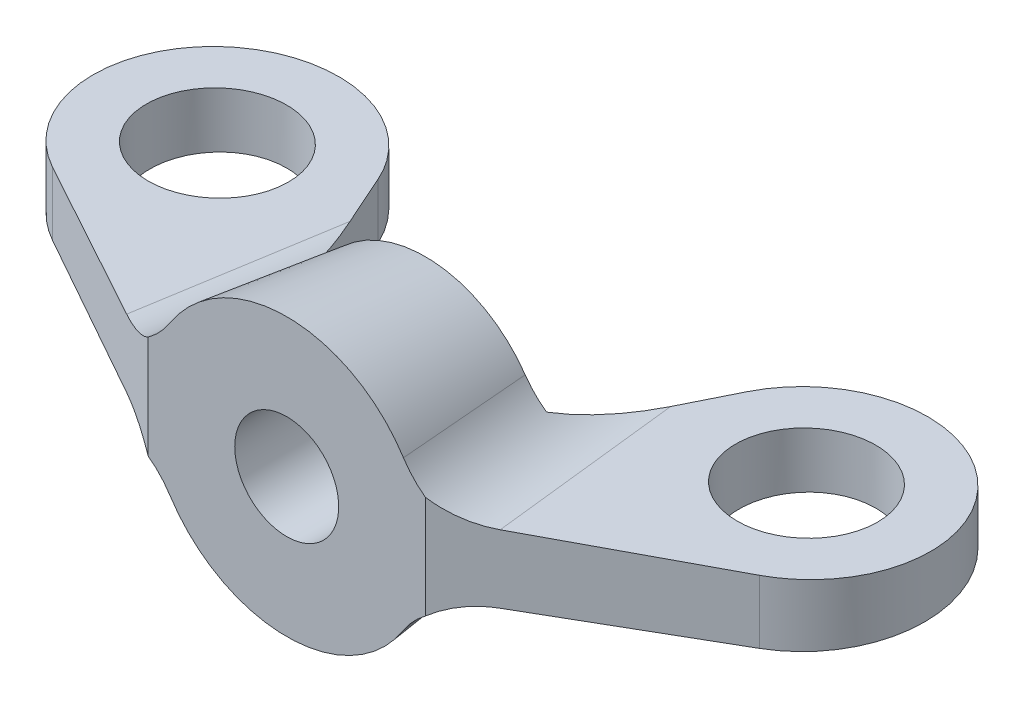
SolidWorks part; units mm, degrees
ref_plane "Front" through (0, 0, 0) normal (0, 0, 1) x (1, 0, 0)
ref_plane "Top" through (0, 0, 0) normal (0, 1, 0) x (1, 0, 0)
ref_plane "Right" through (0, 0, 0) normal (1, 0, 0) x (0, 0, -1)
other "Configuration Table"
sketch "Sketch1" plane through (0, 0, 0) normal (0, 1, 0) x (1, 0, 0)
  line L0 (0, 0) -> (-4, 0)
  line L1 (-4, 0) -> (-3.5, 4)
  line L2 (-3.5, 4) -> (0, 4)
  line L3 (0, 4) -> (0, 0)
  line L4 (0, 81.8931) -> (0, -68.5988) construction
revolve "BaseNut" add sketch "Sketch1" angle 360 about L4
ref_plane "Plane1" through (0, 0, -10) normal (0, 0, 1) x (1, 0, 0)
sketch "Sketch2" plane through (0, 0, 0) normal (0, 0, 1) x (1, 0, 0)
  line L0 (0, 0) -> (1.301, 0) construction
  line L1 (-12, -1) -> (0, -1)
  line L2 (-12, -1) -> (-12, 1)
  line L3 (-12, 1) -> (0, 1)
  line L4 (0, -1) -> (0, 1)
sketch "Sketch3" plane through (17.5788, 0, -10) normal (0, 0, 1) x (-1, 0, 0)
  line L0 (14.5626, 0) -> (37.334, 0) construction
  line L1 (17.5788, -0.75) -> (29.5788, -0.75)
  line L2 (17.5788, -0.75) -> (17.5788, 0.75)
  line L3 (17.5788, 0.75) -> (29.5788, 0.75)
  line L4 (29.5788, -0.75) -> (29.5788, 0.75)
  line L5 (29.5788, 1) -> (29.5788, -1) construction
  dimension "y" = 1.5
loft "Loft1" add profiles "Sketch3", "Sketch2"
sketch "Sketch4" plane through (0, 0, 0) normal (0, 1, 0) x (1, 0, 0)
  line L0 (-4, 0) -> (-10.1983, 3.4396)
  line L2 (-3.5, 4) -> (-5.3195, 7.961)
  line L4 (0, 12.3693) -> (0, -0.3633) construction
  line L6 (-3.5, 4) -> (0, 4)
  line L7 (0, 4) -> (0, 11)
  line L8 (-4, 0) -> (-13, 0)
  line L9 (-3.873, 0) -> (-12, 0) construction
  line L10 (0, 11) -> (-13, 11)
  line L11 (-13, 11) -> (-13, 0)
  line L12 (3.5, 4) -> (-3.3823, 4) construction
  line L13 (-3.873, 0) -> (4, 0) construction
  arc A0 (-5.3195, 7.961) -> (-10.1983, 3.4396) centre (-8.5, 6.5) ccw
extrude "Cut-Extrude1" cut sketch "Sketch4" against normal through all and the other way through all
fillet "Fillet1" radius 2.5 2 edges
mirror "Mirror1" about plane through (0, 0, 0) normal (1, 0, 0) of "Fillet1", "Cut-Extrude1", "Loft1"
sketch "Sketch5" plane through (1.6375, -0.8948, -4) normal (0, 0, -1) x (-1, 0, 0)
  circle A0 centre (1.6375, 0.8948) radius 1.5
  arc A1 (-1.2448, -1.0908) -> (4.5197, -1.0908) centre (1.6375, 0.8948) ccw construction
extrude "Hole1" cut sketch "Sketch5" against normal through all
sketch "Sketch7" plane through (0, 0, 0) normal (0, 1, 0) x (1, 0, 0)
  circle A0 centre (-8.5, 6.5) radius 2
  circle A1 centre (8.5, 6.5) radius 2
  arc A2 (-5.3195, 7.961) -> (-10.1983, 3.4396) centre (-8.5, 6.5) ccw construction
  arc A3 (10.1983, 3.4396) -> (5.3195, 7.961) centre (8.5, 6.5) ccw construction
  dimension "D1" = 4
extrude "Hole2" cut sketch "Sketch7" against normal through all and the other way through all
sketch "Sketch8" plane through (0, 0, 0) normal (0, 1, 0) x (1, 0, 0)
  line L0 (0, 7.8239) -> (0, -2.3836) construction
  line L1 (1.25, 0.125) -> (1.5, 0.125)
  line L2 (1.5, 0.125) -> (1.7165, 0)
  line L3 (1.7165, 0) -> (1.5, -0.125)
  line L4 (1.5, -0.125) -> (1.25, -0.125)
  line L5 (1.25, -0.125) -> (1.25, 0.125)
  line L7 (-1.5, 0) -> (1.5, 0) construction
revolve "Cut-Revolve10" [suppressed] cut sketch "Sketch8" angle 360 about L0
pattern_linear "LPattern10" [suppressed] count 13 spacing 0.3 along (0, 0, 1)
equation "\"dk/2@Sketch4\" = \"dk@Sketch1\" / 2"
equation "\"d/2@Sketch4\" = \"d@Sketch1\" / 2"
equation "\"L/2+1@Sketch4\" = \"l@Sketch4\"/2+1"
equation "\"l/2@Sketch2\" = \"l@Sketch4\"/2"
equation "\"k@Sketch4\" = \"k@Plane1\""
equation "\"k+1@Sketch4\" = \"k@Sketch4\"+1"
equation "\"D2@Sketch8\" = \"D@Sketch5\""
equation "\"D1@Sketch8\" = (  \"D2@ThreadCosmetic1\" - \"D@Sketch5\" )  / 2"
equation "\"D1@LPattern10\" = \"m@Sketch1\" / \"D3@LPattern10\""
equation "\"D3@LPattern10\" = \"D1@Sketch8\" * 1.2"
